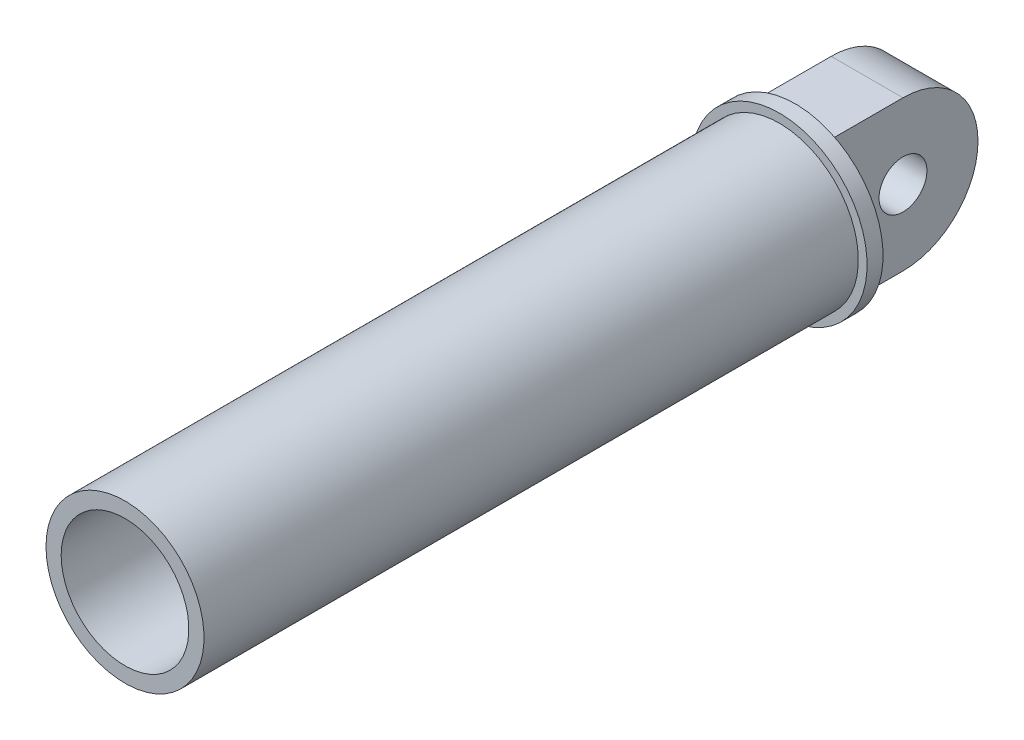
SolidWorks part; units mm, degrees
ref_plane "前视基准面" through (0, 0, 0) normal (0, 0, 1) x (1, 0, 0)
ref_plane "上视基准面" through (0, 0, 0) normal (0, 1, 0) x (1, 0, 0)
ref_plane "右视基准面" through (0, 0, 0) normal (1, 0, 0) x (0, 0, -1)
sketch "草图1" plane through (0, 0, 0) normal (0, 0, 1) x (1, 0, 0)
  circle A0 centre (0, 0) radius 49.5
  circle A1 centre (0, 0) radius 40
  dimension "D1" = 99
  dimension "D2" = 80
extrude "拉伸1" add sketch "草图1" along normal blind 410
sketch "草图2" plane through (0, 0, 0) normal (0, 0, -1) x (-1, 0, 0)
  circle A0 centre (0, 0) radius 55
  dimension "D1" = 110
extrude "拉伸2" add sketch "草图2" along normal blind 10
sketch "草图3" plane through (0, 0, 0) normal (0, 0, 1) x (1, 0, 0)
  circle A1 centre (0, 0) radius 40
  circle A2 centre (0, 0) radius 40
  dimension "D1" = 0
extrude "拉伸3" add sketch "草图3" along normal blind 10
sketch "草图4" plane through (0, 0, 0) normal (1, 0, 0) x (0, 0, -1)
  line L0 (162.286, 0) -> (-66.094, 0) construction
  line L1 (10, -55) -> (10, 55) construction
  line L2 (55, 47) -> (10, 47)
  line L3 (10, 47) -> (10, -47)
  line L4 (10, -47) -> (55, -47)
  arc A0 (55, -47) -> (55, 47) centre (55, 0) ccw
  circle A1 centre (55, 0) radius 15
  dimension "D1" = 94
  dimension "D2" = 45
  dimension "D3" = 30
extrude "拉伸4" add sketch "草图4" along normal mid plane 45
